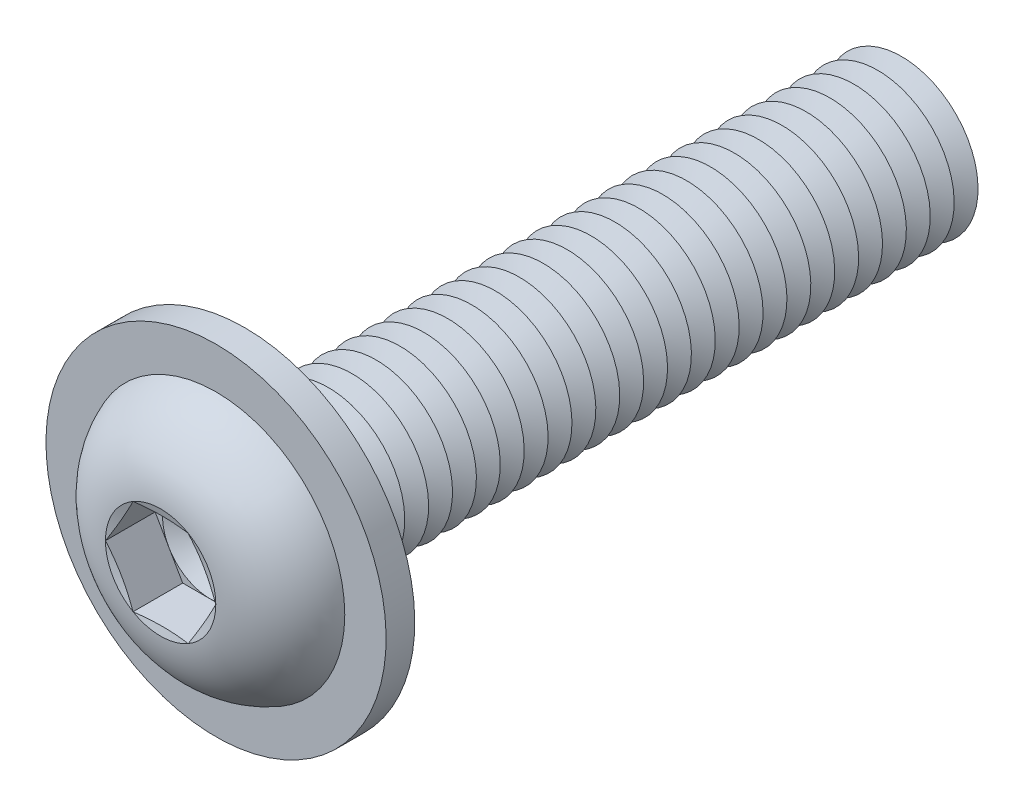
SolidWorks part; units mm, degrees
ref_plane "Front Plane" through (0, 0, 0) normal (0, 0, 1) x (1, 0, 0)
ref_plane "Top Plane" through (0, 0, 0) normal (0, 1, 0) x (1, 0, 0)
ref_plane "Right Plane" through (0, 0, 0) normal (1, 0, 0) x (0, 0, -1)
sketch "Sketch1" plane through (0, 0, 0) normal (1, 0, 0) x (0, 0, -1)
  line L0 (0, 4) -> (0, 7)
  line L3 (0, 4) -> (35, 4)
  line L4 (35, 4) -> (35, 0)
  line L5 (35, 0) -> (-4.4, 0) construction
  line L6 (-4.4, 0) -> (35, 0)
  line L7 (-4.4, 2.8867) -> (-4.4, 1.4434) construction
  line L8 (-4.4, 1.4434) -> (-4.4, 0)
  line L9 (-4.4, 2.8867) -> (-4.0132, 1.4434)
  line L10 (-4.0132, 1.4434) -> (-4.4, 1.4434)
  line L11 (35, 0) -> (22.7481, 0) construction
  line L12 (0, 7) -> (-4.4, 7) construction
  arc A1 (0, 7) -> (-4.4, 2.8867) centre (0, 2.59) ccw
  point P8 (35, 2)
  dimension "D1" = 14
  dimension "D2" = 8
  dimension "D3" = 4.4
  dimension "D4" = 5.7735
  dimension "D5" = 35
  dimension "D6" = 15
revolve "Revolve1" add sketch "Sketch1" angle 360 about L5
fillet "Fillet1" radius 0.625 1 edges at (0, 4, 0)
sketch "Sketch2" plane through (0, 0, 0) normal (1, 0, 0) x (0, 0, -1)
  line L0 (34.375, 4) -> (35.625, 4)
  line L1 (35, 4) -> (0.625, 4) construction
  line L2 (35.625, 4) -> (35, 2.9175)
  line L3 (35, -4) -> (35, 4) construction
  line L4 (35, 2.9175) -> (34.375, 4)
  dimension "D1" = 1.25
revolve "Cut-Revolve1" cut sketch "Sketch2" angle 360 about axis through (0, 0, -35) along (0, 0, -1)
pattern_linear "LPattern1" count 28 spacing 1.25 along (0, 0, 1) of "Cut-Revolve1"
sketch "Sketch3" plane through (0, 0, 4.4) normal (0, 0, 1) x (1, 0, 0)
  line L7 (1.4434, 2.5) -> (-1.4434, 2.5)
  line L8 (-1.4434, 2.5) -> (-2.8867, 0)
  line L9 (-2.8867, 0) -> (-1.4434, -2.5)
  line L10 (-1.4434, -2.5) -> (1.4434, -2.5)
  line L11 (1.4434, -2.5) -> (2.8867, 0)
  line L12 (2.8867, 0) -> (1.4434, 2.5)
  circle A0 centre (0, 0) radius 2.5 construction
  circle A3 centre (0, 0) radius 2.8867 construction
extrude "Cut-Extrude1" cut sketch "Sketch3" against normal blind 2.6
sketch "Sketch4" plane through (0, 0, 1.8) normal (0, 0, 1) x (1, 0, 0)
  line L1 (1.4434, 2.5) -> (-1.4434, 2.5) construction
  circle A0 centre (0, 0) radius 2.5
extrude "Cut-Extrude2" cut sketch "Sketch4" against normal through all draft 60
sketch "Sketch5" plane through (0, 0, 0) normal (0, 0, -1) x (-1, 0, 0)
  circle A0 centre (0, 0) radius 8.9
  circle A1 centre (0, 0) radius 4.625
  circle A2 centre (0, 0) radius 4.625 construction
  dimension "D1" = 17.8
extrude "Boss-Extrude1" add sketch "Sketch5" against normal blind 1.5
